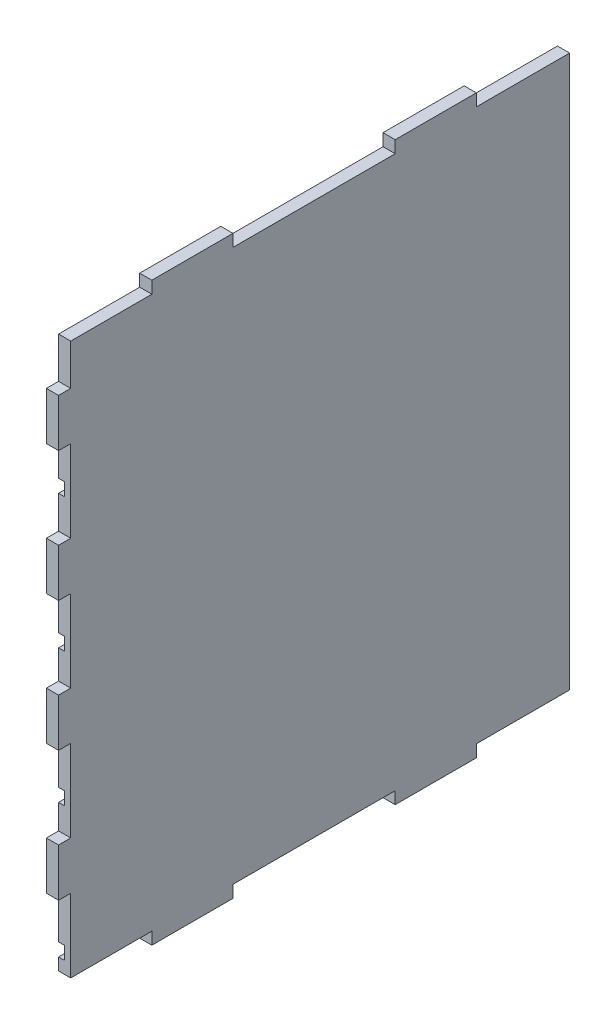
SolidWorks part; units mm, degrees
ref_plane "Alzado" through (0, 0, 0) normal (0, 0, 1) x (1, 0, 0)
ref_plane "Planta" through (0, 0, 0) normal (0, 1, 0) x (1, 0, 0)
ref_plane "Vista lateral" through (0, 0, 0) normal (1, 0, 0) x (0, 0, -1)
sketch "Croquis1" plane through (0, 0, 0) normal (0, 0, 1) x (1, 0, 0)
  line L0 (-7.5, 710) -> (-7.5, 0) construction
  line L1 (0, 0) -> (-15, 0)
  line L2 (0, 0) -> (0, 710)
  line L3 (0, 710) -> (-15, 710)
  line L4 (-15, 0) -> (-15, 30)
  line L5 (-15, 30) -> (-7.5, 30)
  line L6 (-7.5, 30) -> (-7.5, 46)
  line L7 (-7.5, 46) -> (-15, 46)
  line L8 (-7.5, 211) -> (-15, 211)
  line L9 (-7.5, 195) -> (-7.5, 211)
  line L10 (-15, 195) -> (-7.5, 195)
  line L11 (-7.5, 376) -> (-15, 376)
  line L12 (-7.5, 360) -> (-7.5, 376)
  line L13 (-15, 360) -> (-7.5, 360)
  line L14 (-7.5, 541) -> (-15, 541)
  line L15 (-7.5, 525) -> (-7.5, 541)
  line L16 (-15, 525) -> (-7.5, 525)
  line L17 (-15, 46) -> (-15, 195)
  line L18 (-15, 211) -> (-15, 360)
  line L19 (-15, 376) -> (-15, 525)
  line L20 (-15, 541) -> (-15, 710)
extrude "Saliente-Extruir1" add sketch "Croquis1" along normal blind 630
sketch "Croquis2" plane through (0, 0, 0) normal (1, 0, 0) x (0, 0, -1)
  line L0 (0, 0) -> (0, 710) construction
  line L1 (0, 15) -> (-115, 15)
  line L2 (-115, 15) -> (-115, 0)
  line L3 (-630, 0) -> (0, 0) construction
  line L4 (-115, 0) -> (0, 0)
  line L5 (0, 0) -> (0, 15)
  line L6 (-215, 0) -> (-215, 15)
  line L7 (-215, 15) -> (-415, 15)
  line L8 (-415, 15) -> (-415, 0)
  line L9 (-415, 0) -> (-215, 0)
  line L10 (-630, 0) -> (-630, 15)
  line L11 (-630, 0) -> (-630, 710) construction
  line L12 (-630, 15) -> (-515, 15)
  line L13 (-515, 15) -> (-515, 0)
  line L14 (-515, 0) -> (-630, 0)
  line L15 (-515, 15) -> (-415, 15) construction
  line L16 (-215, 15) -> (-115, 15) construction
  line L17 (0, 355) -> (-630, 355) construction
  line L18 (-215, 695) -> (-115, 695) construction
  line L19 (-515, 695) -> (-415, 695) construction
  line L20 (-515, 710) -> (-630, 710)
  line L21 (-515, 695) -> (-515, 710)
  line L22 (-630, 695) -> (-515, 695)
  line L23 (-630, 710) -> (-630, 695)
  line L24 (-415, 710) -> (-215, 710)
  line L25 (-415, 695) -> (-415, 710)
  line L26 (-215, 695) -> (-415, 695)
  line L27 (-215, 710) -> (-215, 695)
  line L28 (0, 710) -> (0, 695)
  line L29 (-115, 710) -> (0, 710)
  line L30 (-115, 695) -> (-115, 710)
  line L31 (0, 695) -> (-115, 695)
  point P18 (-165, 15)
  point P21 (-465, 15)
extrude "Cortar-Extruir1" cut sketch "Croquis2" against normal through all
sketch "Croquis3" plane through (-15, 0, 0) normal (-1, 0, 0) x (0, 0, 1)
  line L27 (315, 695) -> (315, 15) construction
  line L28 (415, 695) -> (215, 695) construction
  line L29 (215, 15) -> (415, 15) construction
  line L30 (630, 484.5) -> (630, 425.5) construction
  line L31 (630, 265.5) -> (630, 324.5) construction
  line L32 (630, 644.5) -> (630, 585.5) construction
  line L33 (630, 105.5) -> (630, 164.5) construction
  line L34 (615, 644.5) -> (615, 745.5)
  line L35 (630, 745.5) -> (615, 745.5)
  line L36 (630, 644.5) -> (630, 745.5)
  line L37 (630, 644.5) -> (615, 644.5)
  line L38 (615, 585.5) -> (615, 484.5)
  line L39 (630, 484.5) -> (615, 484.5)
  line L40 (630, 585.5) -> (630, 484.5)
  line L41 (630, 585.5) -> (615, 585.5)
  line L42 (615, 425.5) -> (615, 324.5)
  line L43 (630, 324.5) -> (615, 324.5)
  line L44 (630, 425.5) -> (630, 324.5)
  line L45 (630, 425.5) -> (615, 425.5)
  line L46 (615, 265.5) -> (615, 164.5)
  line L47 (630, 164.5) -> (615, 164.5)
  line L48 (630, 265.5) -> (630, 164.5)
  line L49 (630, 265.5) -> (615, 265.5)
  line L50 (615, 105.5) -> (615, 4.5)
  line L51 (630, 4.5) -> (615, 4.5)
  line L52 (630, 105.5) -> (630, 4.5)
  line L53 (630, 105.5) -> (615, 105.5)
extrude "Cortar-Extruir3" cut sketch "Croquis3" against normal through all
equation "\"D1@Croquis1\"= \"thicknes\""
equation "\"thicknes\"=15"
equation "\"profbase\"= 400"
equation "\"anchbase\"= 400"
equation "\"altura\"=150"
equation "\"clearens\"=0"
equation "\"joind1\"=100"
equation "\"D3@Croquis1\"=\"thicknes\"+1"
equation "\"profmueble\" = \"profbase\" + 200 + 2 * \"thicknes\""
equation "\"D1@Saliente-Extruir1\"=\"profmueble\""
equation "\"Malto\"= 710"
equation "\"D2@Croquis1\" = \"Malto\""
equation "\"D1@Croquis2\"=\"joind1\""
equation "\"D2@Croquis2\"=\"joind1\""
equation "\"D4@Croquis2\"=\"thicknes\""
